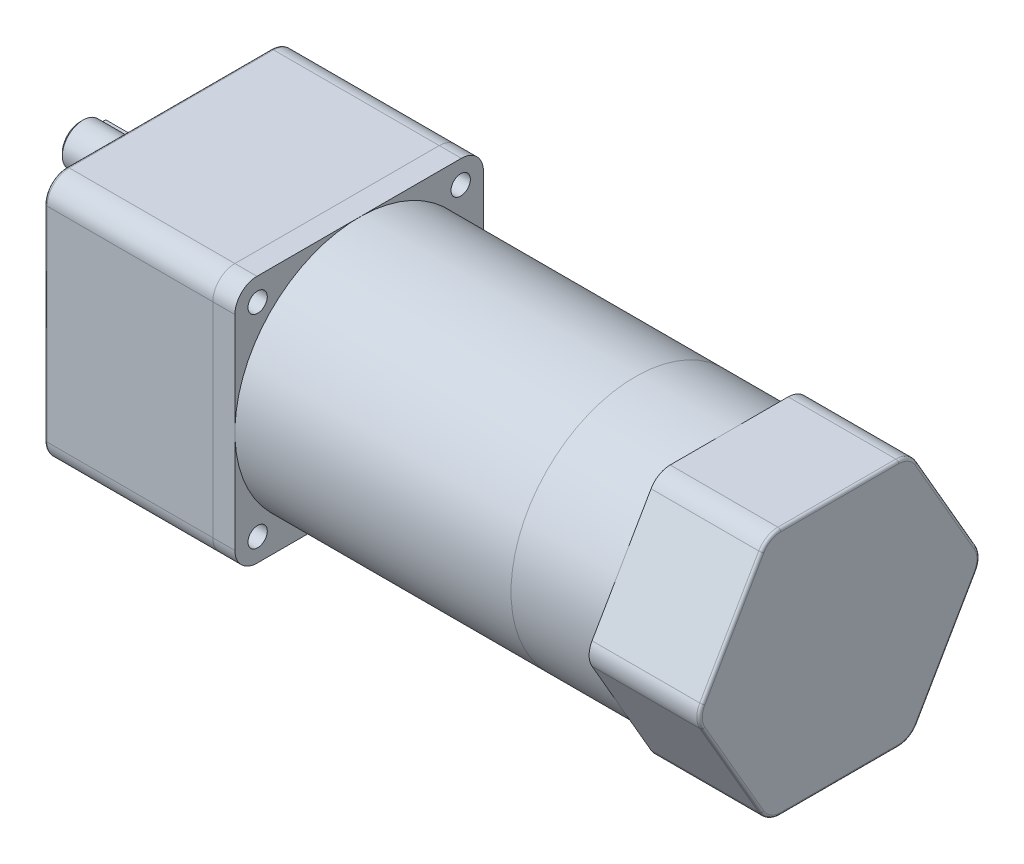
SolidWorks part; units mm, degrees
ref_plane "前视基准面" through (0, 0, 0) normal (0, 0, 1) x (1, 0, 0)
ref_plane "上视基准面" through (0, 0, 0) normal (0, 1, 0) x (1, 0, 0)
ref_plane "右视基准面" through (0, 0, 0) normal (1, 0, 0) x (0, 0, -1)
sketch "草图1" plane through (0, 0, 0) normal (1, 0, 0) x (0, 0, -1)
  line L1 (-37, -45) -> (37, -45)
  line L2 (-45, -37) -> (-45, 37)
  line L3 (-37, 45) -> (37, 45)
  line L4 (45, -37) -> (45, 37)
  line L5 (-45, -45) -> (45, 45) construction
  line L6 (-45, 45) -> (45, -45) construction
  arc A0 (-37, -45) -> (-45, -37) centre (-37, -37) cw
  arc A1 (-45, 37) -> (-37, 45) centre (-37, 37) cw
  arc A2 (37, 45) -> (45, 37) centre (37, 37) cw
  arc A3 (37, -45) -> (45, -37) centre (37, -37) ccw
  point P0 (0, 0)
  dimension "D1" = 8
extrude "凸台-拉伸1" add sketch "草图1" along normal blind 61
sketch "草图2" plane through (61, 0, 0) normal (1, 0, 0) x (0, 0, -1)
  line L0 (37, 45) -> (-37, 45) construction
  line L1 (-37, -45) -> (37, -45)
  line L2 (-45, -37) -> (-45, 37)
  line L3 (-37, 45) -> (37, 45)
  line L4 (45, -37) -> (45, 37)
  line L5 (-45, -45) -> (45, 45) construction
  line L6 (-45, 45) -> (45, -45) construction
  arc A0 (37, 45) -> (45, 37) centre (37, 37) cw
  arc A1 (37, -45) -> (45, -37) centre (37, -37) ccw
  arc A2 (-37, -45) -> (-45, -37) centre (-37, -37) cw
  arc A3 (-45, 37) -> (-37, 45) centre (-37, 37) cw
  point P0 (0, 0)
  dimension "D1" = 8
extrude "凸台-拉伸2" add sketch "草图2" along normal blind 8 separate body
sketch "草图3" plane through (69, 0, 0) normal (1, 0, 0) x (0, 0, -1)
  circle A0 centre (0, 0) radius 45
extrude "凸台-拉伸3" add sketch "草图3" along normal blind 100 separate body
sketch "草图4" plane through (169, 0, 0) normal (1, 0, 0) x (0, 0, -1)
  circle A0 centre (0, 0) radius 45
extrude "凸台-拉伸4" add sketch "草图4" along normal blind 34 separate body
sketch "草图5" plane through (203, 0, 0) normal (1, 0, 0) x (0, 0, -1)
  line L1 (21.362, 45) -> (-21.362, 45)
  line L2 (-28.2902, 41) -> (-49.6521, 4)
  line L3 (-49.6521, -4) -> (-28.2902, -41)
  line L4 (-21.362, -45) -> (21.362, -45)
  line L5 (28.2902, -41) -> (49.6521, -4)
  line L6 (49.6521, 4) -> (28.2902, 41)
  circle A0 centre (0, 0) radius 45 construction
  arc A1 (-49.6521, 4) -> (-49.6521, -4) centre (-42.7239, 0) ccw
  arc A2 (-28.2902, -41) -> (-21.362, -45) centre (-21.362, -37) ccw
  arc A3 (21.362, -45) -> (28.2902, -41) centre (21.362, -37) ccw
  arc A4 (49.6521, -4) -> (49.6521, 4) centre (42.7239, 0) ccw
  arc A5 (21.362, 45) -> (28.2902, 41) centre (21.362, 37) cw
  arc A6 (-21.362, 45) -> (-28.2902, 41) centre (-21.362, 37) ccw
  dimension "D1" = 8
extrude "凸台-拉伸5" add sketch "草图5" along normal blind 40 separate body
fillet "圆角1" radius 1 12 edges at (243, 22.5, 38.9711) (243, 43.9282, 25.362) (243, 45, 0) (243, 43.9282, -25.362) (243, 22.5, -38.9711) (243, 0, -50.7239) (243, -22.5, -38.9711) (243, -43.9282, -25.362) (243, -45, 0) (243, -43.9282, 25.362) (243, -22.5, 38.9711) (243, 0, 50.7239)
fillet "圆角2" radius 1 8 edges at (0, -45, 0) (0, -42.6569, -42.6569) (0, 0, -45) (0, 42.6569, -42.6569) (0, 45, 0) (0, 42.6569, 42.6569) (0, 0, 45) (0, -42.6569, 42.6569)
sketch "草图6" plane through (0, 0, 0) normal (-1, 0, 0) x (0, 0, 1)
  point P19 (36.7696, 36.7696)
  point P20 (36.7696, -36.7696)
  point P21 (-36.7696, -36.7696)
  point P22 (-36.7696, 36.7696)
hole_wizard "M6 螺纹孔1" positions "3D草图1" profile "草图7" tap size "M6" standard "GB"
sketch3d "3D草图1"
  point P0 (0, 36.7696, 36.7696)
  point P3 (0, -36.7696, 36.7696)
  point P6 (0, 36.7696, -36.7696)
  point P9 (0, -36.7696, -36.7696)
sketch "草图7" plane through (0, 36.7696, 36.7696) normal (0, 1, 0) x (0, 0, 1)
  line L0 (0, 0) -> (0, 18.5022)
  line L1 (0, 18.5022) -> (2.5, 17)
  line L2 (2.5, 17) -> (2.5, 0)
  line L5 (2.5, 0) -> (0, 0)
  line L10 (0, 18.5022) -> (-2.5, 17) construction
  line L11 (0, -6.35) -> (0, 107.95) construction
  dimension "螺纹孔钻头直径" = 5
  dimension "螺纹孔钻头深度" = 17
  dimension "导头角度" = 118
sketch "草图8" plane through (69, 0, 0) normal (1, 0, 0) x (0, 0, -1)
  line L1 (42.6569, -42.6569) -> (42.6569, 42.6569)
  arc A2 (37, -45) -> (45, -37) centre (37, -37) ccw construction
  arc A3 (45, 37) -> (37, 45) centre (37, 37) ccw construction
  circle A5 centre (-36.7696, 36.7696) radius 3.5
  circle A6 centre (36.7696, 36.7696) radius 3.5
  circle A7 centre (36.7696, -36.7696) radius 3.5
  circle A8 centre (-36.7696, -36.7696) radius 3.5
extrude "切除-拉伸1" cut sketch "草图8" against normal blind 26 contours A5 | A6 | A7 | A8
sketch "草图9" plane through (0, 0, 0) normal (-1, 0, 0) x (0, 0, 1)
  circle A0 centre (0, 18) radius 16
extrude "凸台-拉伸6" add sketch "草图9" along normal blind 3
fillet "圆角3" radius 0.5 1 edges at (-3, 18, 16)
sketch "草图10" plane through (0, 0, 0) normal (-1, 0, 0) x (0, 0, 1)
  circle A0 centre (0, 0) radius 41.4
extrude "切除-拉伸2" cut sketch "草图10" against normal blind 0.5
fillet "圆角4" radius 0.5 1 edges at (0, 0, 41.4)
sketch "草图11" plane through (-3, 0, 0) normal (-1, 0, 0) x (0, 0, 1)
  circle A0 centre (0, 18) radius 7.5
extrude "凸台-拉伸7" add sketch "草图11" along normal blind 29 separate body
ref_plane "基准面1" through (0, 0, -7.5) normal (0, 0, 1) x (1, 0, 0)
sketch "草图12" plane through (0, 0, -7.5) normal (0, 0, 1) x (1, 0, 0)
  line L1 (-32, 25.5) -> (-32, 10.5) construction
  line L2 (-9.5, 20.5) -> (-32, 20.5)
  line L3 (-32, 20.5) -> (-32, 15.5)
  line L4 (-32, 15.5) -> (-9.5, 15.5)
  arc A0 (-9.5, 15.5) -> (-9.5, 20.5) centre (-9.5, 18) ccw
extrude "切除-拉伸4" cut sketch "草图12" along normal blind 3
sketch "草图13" plane through (0, 0, -4.5) normal (0, 0, -1) x (-1, 0, 0)
  line L0 (9.5, 20.5) -> (32, 20.5)
  line L1 (32, 20.5) -> (32, 15.5)
  line L2 (32, 15.5) -> (9.5, 15.5)
  arc A0 (9.5, 20.5) -> (9.5, 15.5) centre (9.5, 18) ccw
extrude "凸台-拉伸8" add sketch "草图13" along normal blind 5 separate body
chamfer "倒角1" distance 0.3 angle 45 4 edges at (-7, 18, -9.5) (-20.75, 15.5, -9.5) (-32, 18, -9.5) (-20.75, 20.5, -9.5)
chamfer "倒角2" distance 1 angle 45 1 edges at (-32, 18, 7.5)
